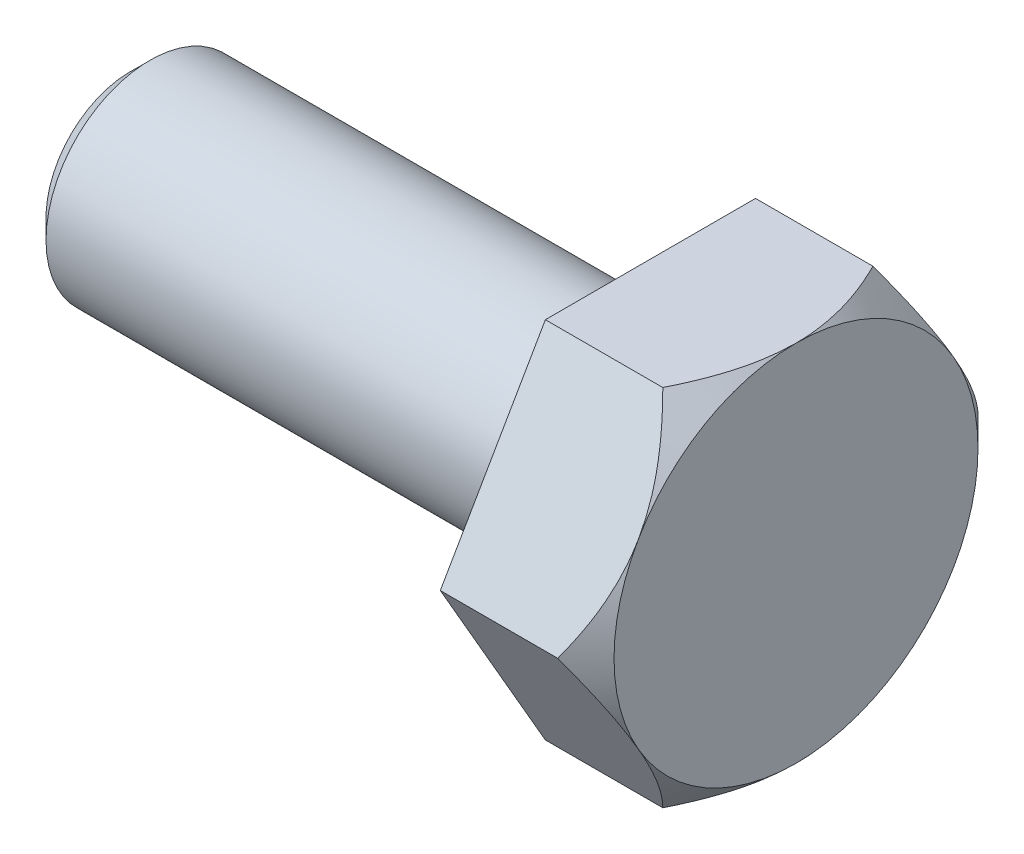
SolidWorks part; units mm, degrees
ref_plane "Plan1" through (0, 0, 0) normal (0, 0, 1) x (1, 0, 0)
ref_plane "Plan2" through (0, 0, 0) normal (0, 1, 0) x (1, 0, 0)
ref_plane "Plan3" through (0, 0, 0) normal (1, 0, 0) x (0, 0, -1)
sketch "Esquisse1" plane through (0, 0, 0) normal (0, 0, 1) x (1, 0, 0)
  line L0 (12.4996, 0) -> (-84.5713, 0) construction
  line L1 (0, -2) -> (0, -5.25)
  line L2 (0, -2) -> (-10, -2)
  line L3 (-10, -2) -> (-10, 0)
  line L4 (0, -5.25) -> (2.8, -5.25)
  line L5 (2.8, -5.25) -> (2.8, 0)
  line L6 (-10, 0) -> (2.8, 0)
revolve "Base-Révolution" add sketch "Esquisse1" angle 360 about L0
chamfer "Chanfrein tige" distance 0.375 angle 45 1 edges at (-10, 0, -2)
sketch "Esquisse2" plane through (2.8, 0, 0) normal (1, 0, 0) x (0, 0, -1)
  line L1 (4.0415, 0) -> (2.0207, 3.5)
  line L2 (2.0207, 3.5) -> (-2.0207, 3.5)
  line L3 (-2.0207, 3.5) -> (-4.0415, 0)
  line L4 (-4.0415, 0) -> (-2.0207, -3.5)
  line L5 (-2.0207, -3.5) -> (2.0207, -3.5)
  line L6 (2.0207, -3.5) -> (4.0415, 0)
  circle A0 centre (0, 0) radius 3.5 construction
  circle A1 centre (0, 0) radius 4.0415 construction
  circle A2 centre (0, 0) radius 5.25
  circle A3 centre (0, 0) radius 5.25 construction
extrude "Enlèv. mat.-Extru.1" cut sketch "Esquisse2" against normal up to next
sketch "Esquisse3" plane through (2.8, 0, 0) normal (1, 0, 0) x (0, 0, -1)
  line L0 (4.0415, 0) -> (2.0207, 3.5) construction
  circle A0 centre (0, 0) radius 3.5
extrude "Enlèv. mat.-Extru.2" cut sketch "Esquisse3" against normal blind 3 draft 45 flip side to cut
equation "\"Ø tete@Esquisse1\"=\"Cote sur plats@Esquisse2\"*1.5"
